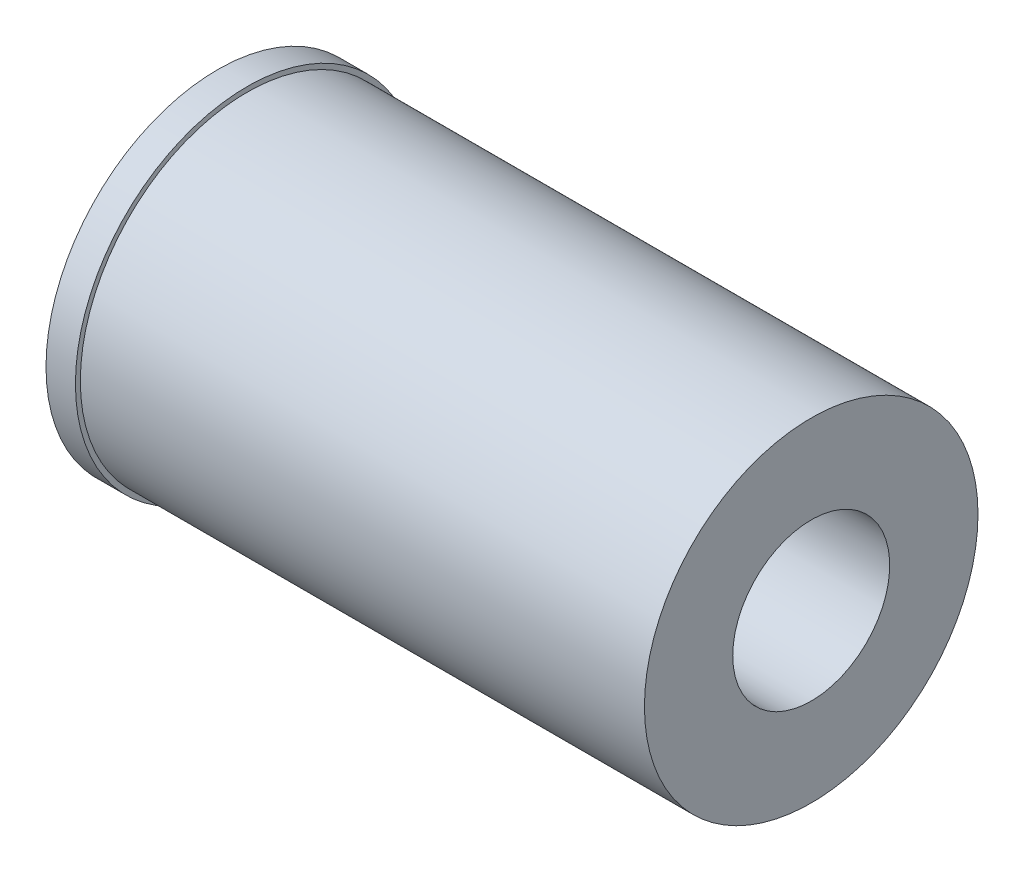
SolidWorks part; units mm, degrees
ref_plane "Face" through (0, 0, 0) normal (0, 0, 1) x (1, 0, 0)
ref_plane "Dessus" through (0, 0, 0) normal (0, 1, 0) x (1, 0, 0)
ref_plane "Droite" through (0, 0, 0) normal (1, 0, 0) x (0, 0, -1)
sketch "Esquisse1" plane through (0, 0, 0) normal (0, 0, 1) x (1, 0, 0)
  line L0 (0, 0) -> (61.7463, 0) construction
  line L1 (0, 0) -> (0, 3.5)
  line L2 (0, 3.5) -> (0.6, 3.5)
  line L3 (0.6, 3.5) -> (0.6, 3.4)
  line L4 (0.6, 3.4) -> (12.1, 3.4)
  line L5 (12.1, 3.4) -> (12.1, 1.6)
  line L6 (12.1, 1.6) -> (1.4, 1.6)
  line L7 (1.4, 1.6) -> (1.4, 0.8)
  line L8 (1.4, 0.8) -> (0.6, 0.8)
  line L9 (0.6, 0.8) -> (0.6, 0)
  line L10 (0.6, 0) -> (0, 0)
  dimension "D1" = 0.8
  dimension "D2" = 0.6
  dimension "D3" = 0.8
  dimension "D4" = 3.5
  dimension "D5" = 0.1
  dimension "D6" = 11.5
  dimension "D7" = 0.8
revolve "Révolution1" add sketch "Esquisse1" angle 360 about L0
